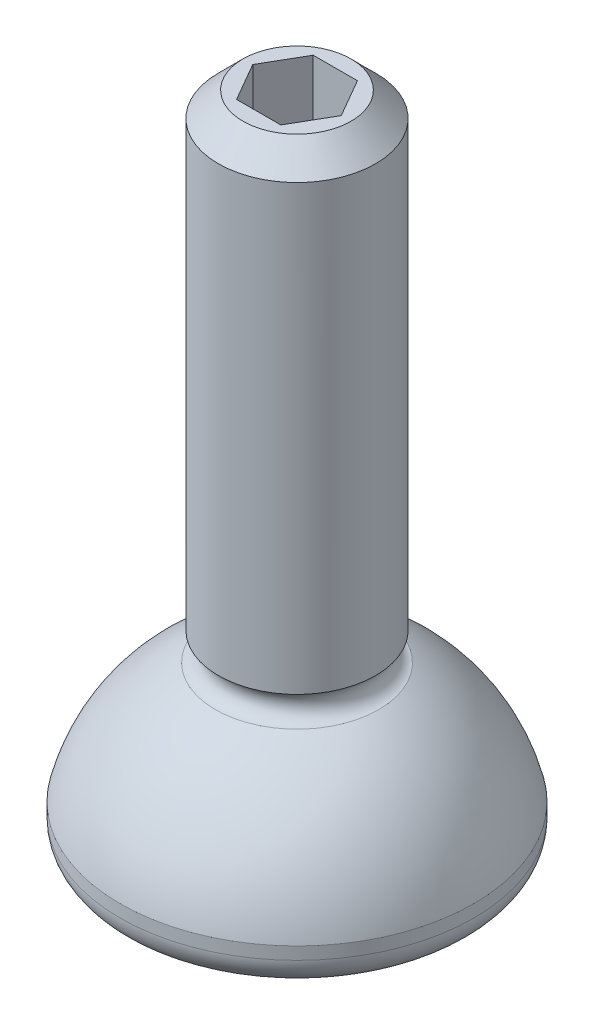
SolidWorks part; units mm, degrees
ref_plane "Front Plane" through (0, 0, 0) normal (0, 0, 1) x (1, 0, 0)
ref_plane "Top Plane" through (0, 0, 0) normal (0, 1, 0) x (1, 0, 0)
ref_plane "Right Plane" through (0, 0, 0) normal (1, 0, 0) x (0, 0, -1)
sketch "Sketch1" plane through (0, 0, 0) normal (0, 0, 1) x (1, 0, 0)
  line L0 (0, -1000) -> (0, 49000) construction
  line L1 (0, 0) -> (4.572, 0)
  line L2 (55, 0) -> (-55, 0) construction
  line L3 (4.572, 0) -> (4.572, 1.0851)
  line L5 (2.032, 4.2369) -> (2.032, 17.018)
  line L6 (2.032, 17.018) -> (0, 17.018)
  line L7 (0, 17.018) -> (0, 0)
  arc A0 (4.572, 1.0851) -> (2.032, 4.2369) centre (0, 0) ccw
  dimension "D4" = 4.699
  dimension "D1" = 17.018
  dimension "D2" = 4.064
  dimension "D3" = 9.144
revolve "Revolve1" add sketch "Sketch1" angle 360 about L0
chamfer "Chamfer1" distance 0.635 angle 45 1 edges at (2.032, 17.018, 0)
fillet "Fillet1" radius 0.762 1 edges at (4.572, 0, 0)
hole_wizard "Hole1" positions "3DSketch1" profile "Sketch3" legacy
sketch3d "3DSketch1"
  point P0 (0, 17.018, 0)
  dimension "D1" = 17.018
sketch "Sketch3" plane through (0, 17.018, 0) normal (1, 0, 0) x (0, 0, 1)
  line L0 (0, 0) -> (0, 3.8972)
  line L1 (0, 3.8972) -> (0.9906, 3.302)
  line L2 (0.9906, 3.302) -> (0.9906, 0)
  line L4 (0.9906, 0) -> (0, 0)
  line L6 (0, 3.8972) -> (-0.9906, 3.302) construction
  line L7 (0, -4.2442) -> (0, 117.3081) construction
  dimension "Diameter" = 1.9812
  dimension "Depth" = 3.302
  dimension "Drill Angle" = 118
sketch "Sketch4" plane through (0, 17.018, 0) normal (0, 1, 0) x (1, 0, 0)
  line L1 (0.5719, 0.9906) -> (-0.5719, 0.9906)
  line L2 (-0.5719, 0.9906) -> (-1.1438, 0)
  line L3 (-1.1438, 0) -> (-0.5719, -0.9906)
  line L4 (-0.5719, -0.9906) -> (0.5719, -0.9906)
  line L5 (0.5719, -0.9906) -> (1.1438, 0)
  line L6 (1.1438, 0) -> (0.5719, 0.9906)
  circle A0 centre (0, 0) radius 0.9906 construction
  dimension "D1" = 1.9812
extrude "Cut-Extrude1" cut sketch "Sketch4" against normal blind 2.032
sketch "Sketch5" plane through (0, 0, 0) normal (0, 0, 1) x (1, 0, 0)
  line L0 (5.0292, 0) -> (-5.0292, 0) construction
  line L1 (0, -5.0292) -> (0, 5.0292) construction
  line L2 (0, -1000) -> (0, 49000) construction
  circle A0 centre (2.1844, 4.572) radius 0.381
  dimension "D3" = 0.762
  dimension "D1" = 4.572
  dimension "D2" = 2.1844
revolve "Cut-Revolve1" cut sketch "Sketch5" angle 360 about L2
ref_point "Point1"
